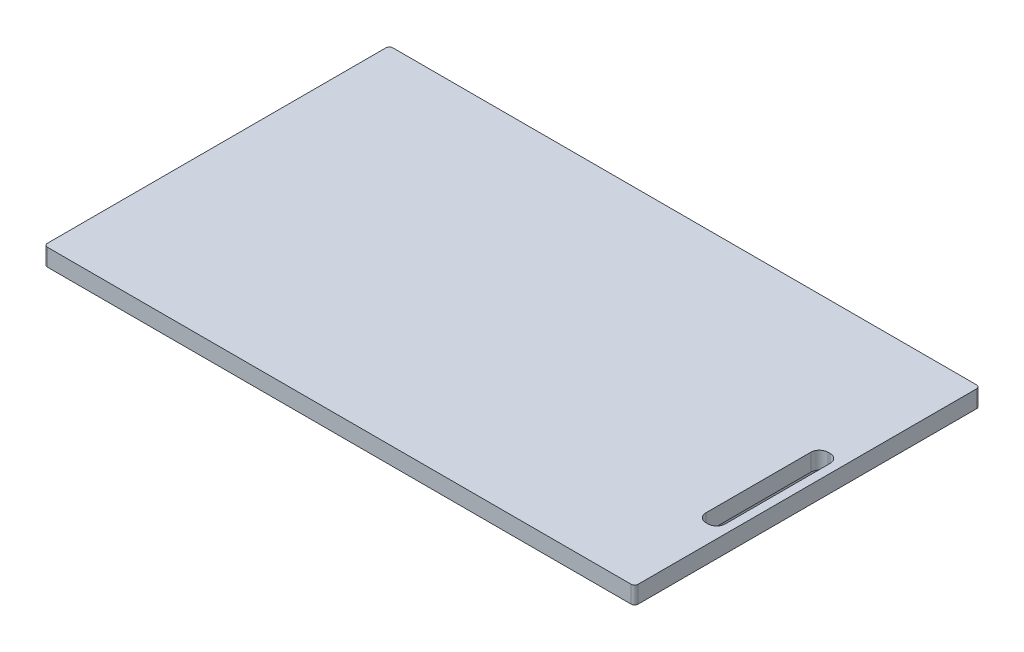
SolidWorks part; units mm, degrees
ref_plane "Plan de face" through (0, 0, 0) normal (0, 0, 1) x (1, 0, 0)
ref_plane "Plan de dessus" through (0, 0, 0) normal (0, 1, 0) x (1, 0, 0)
ref_plane "Plan de droite" through (0, 0, 0) normal (1, 0, 0) x (0, 0, -1)
sketch "Esquisse1" plane through (0, 0, 0) normal (0, 1, 0) x (0, 0, -1)
  line L1 (-100, 171) -> (100, 171)
  line L2 (-100, 171) -> (-100, -171)
  line L3 (-100, -171) -> (100, -171)
  line L4 (100, 171) -> (100, -171)
  line L5 (-100, 171) -> (100, -171) construction
  line L6 (-100, -171) -> (100, 171) construction
  point P0 (0, 0)
  dimension "D1" = 200
  dimension "D2" = 342
extrude "Boss.-Extru.1" add sketch "Esquisse1" along normal blind 19
sketch "Esquisse2" plane through (0, 19, 0) normal (0, 1, 0) x (1, 0, 0)
  line L0 (-171, -100) -> (171, -100) construction
  line L1 (154.8, 23.2) -> (166, 23.2)
  line L2 (154.8, 23.2) -> (154.8, -47.5)
  line L3 (154.8, -47.5) -> (166, -47.5)
  line L4 (166, 23.2) -> (166, -47.5)
  line L5 (171, -100) -> (171, 100) construction
  dimension "D1" = 70.7
  dimension "D2" = 52.5
  dimension "D3" = 5
  dimension "D4" = 11.2
extrude "Enlèv. mat.-Extru.1" cut sketch "Esquisse2" against normal up to next
fillet "Congé1" radius 5 4 edges at (166, 9.5, 47.5) (154.8, 9.5, 47.5) (166, 9.5, -23.2) (154.8, 9.5, -23.2)
sketch "Esquisse4" plane through (0, 0, 0) normal (0, -1, 0) x (1, 0, 0)
  line L0 (-151.5, 11) -> (-171, 11) construction
  line L1 (-151.5, 80.5) -> (151.5, 80.5)
  line L2 (-151.5, 80.5) -> (-151.5, -58.5)
  line L3 (-151.5, -58.5) -> (151.5, -58.5)
  line L4 (151.5, 80.5) -> (151.5, -58.5)
  line L5 (-171, 100) -> (171, 100)
  line L6 (-171, 100) -> (-171, -100)
  line L7 (-171, -100) -> (171, -100)
  line L8 (171, 100) -> (171, -100)
  line L9 (0, 80.5) -> (0, 100) construction
  line L11 (151.5, 11) -> (171, 11) construction
  dimension "D1" = 139
  dimension "D2" = 19.5
extrude "Enlèv. mat.-Extru.2" cut sketch "Esquisse4" against normal blind 9
fillet "Congé3" radius 2 8 edges at (-151.5, 4.5, -58.5) (-171, 14, -100) (151.5, 4.5, -58.5) (171, 14, -100) (151.5, 4.5, 80.5) (171, 14, 100) (-151.5, 4.5, 80.5) (-171, 14, 100)
